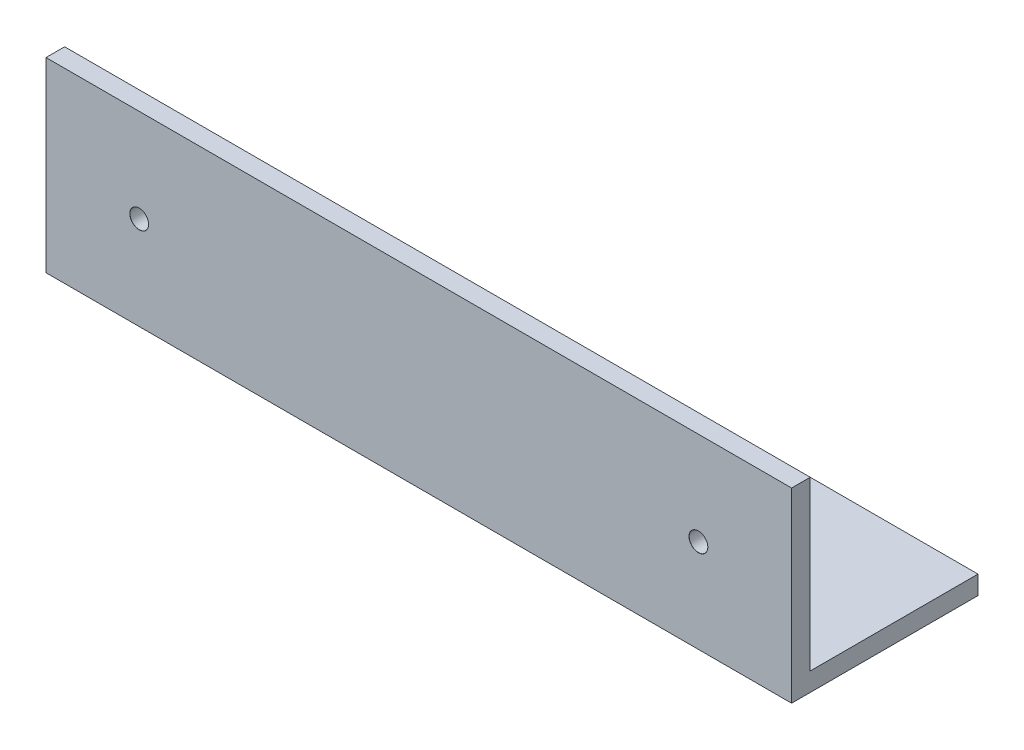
SolidWorks part; units mm, degrees
other "Connection Feature" parameters "D1"=200
ref_plane "Front Plane" through (0, 0, 0) normal (0, 0, 1) x (1, 0, 0)
ref_plane "Top Plane" through (0, 0, 0) normal (0, 1, 0) x (1, 0, 0)
ref_plane "Right Plane" through (0, 0, 0) normal (1, 0, 0) x (0, 0, -1)
sketch "Sketch2" plane through (0, 0, 0) normal (1, 0, 0) x (0, 0, -1)
  line L0 (0, 50) -> (0, 0)
  line L1 (0, 0) -> (50, 0)
extrude "Extrude-Thin1" add sketch "Sketch2" along normal mid plane 200 thin
sketch "Sketch3" plane through (0, 0, -5) normal (0, 0, -1) x (-1, 0, 0)
  line L0 (0, 0) -> (0, 50) construction
  line L1 (-100, 50) -> (100, 50) construction
  line L2 (-75, 25) -> (75, 25) construction
  point P8 (0, 25)
  dimension "D1" = 150
hole_wizard "Ø5.0mm Dowel Hole1" positions "Sketch4" profile "Sketch5" hole size "Ø5.0" standard "ANSI Metric"
sketch "Sketch4" plane through (0, 0, -5) normal (0, 0, -1) x (-1, 0, 0)
  point P0 (-75, 25)
  point P3 (75, 25)
sketch "Sketch5" plane through (75, 25, -5) normal (1, 0, 0) x (0, 1, 0)
  line L0 (0, 0) -> (0, 5)
  line L1 (0, 5) -> (2.525, 5)
  line L2 (2.5, 4.975) -> (2.5, 0)
  line L5 (2.5, 0) -> (0, 0)
  line L7 (2.525, 5) -> (2.5, 4.975)
  line L8 (-2.525, 5) -> (-2.5, 4.975) construction
  line L11 (0, -6.35) -> (0, 107.95) construction
  dimension "Thru Hole Dia." = 5
  dimension "Thru Hole Depth" = 5
  dimension "Far C'Sink Dia." = 5.05
  dimension "Far C'Sink Angle" = 90
hole_wizard "Ø5.0mm Dowel Hole2" positions "Sketch6" profile "Sketch7" hole size "Ø5.0" standard "ANSI Metric"
sketch "Sketch6" plane through (0, 5, 0) normal (0, 1, 0) x (-1, 0, 0)
  line L0 (0, 0) -> (0, -50) construction
  line L1 (-100, -50) -> (100, -50) construction
  line L4 (-75, -25) -> (75, -25) construction
  line L8 (-75, -5) -> (75, -5) construction
  point P36 (-75, -25)
  point P38 (75, -25)
  point P44 (0, -25)
sketch "Sketch7" plane through (-75, 5, -25) normal (1, 0, 0) x (0, 0, 1)
  line L0 (0, 0) -> (0, 5)
  line L1 (0, 5) -> (2.525, 5)
  line L2 (2.5, 4.975) -> (2.5, 0)
  line L5 (2.5, 0) -> (0, 0)
  line L7 (2.525, 5) -> (2.5, 4.975)
  line L8 (-2.525, 5) -> (-2.5, 4.975) construction
  line L11 (0, -6.35) -> (0, 107.95) construction
  dimension "Thru Hole Dia." = 5
  dimension "Thru Hole Depth" = 5
  dimension "Far C'Sink Dia." = 5.05
  dimension "Far C'Sink Angle" = 90
other "Configuration Table"
